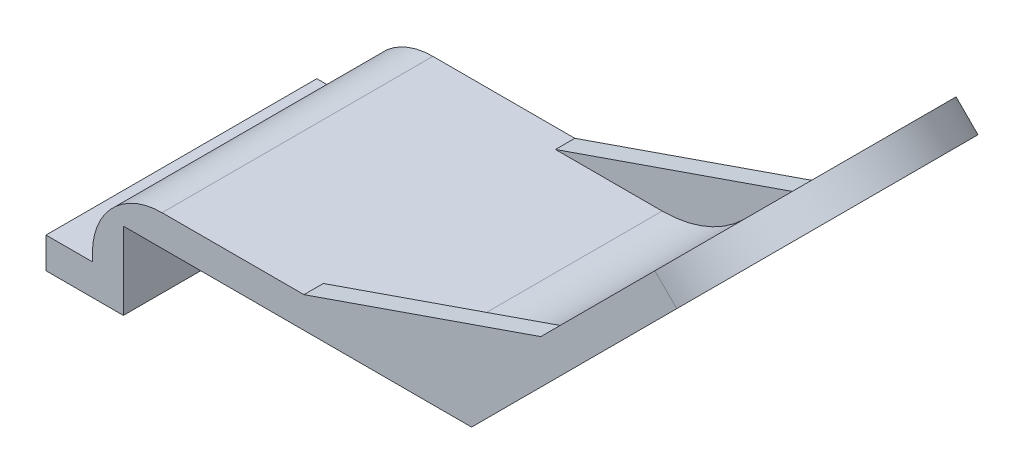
SolidWorks part; units mm, degrees
ref_plane "Front Plane" through (0, 0, 0) normal (0, 0, 1) x (1, 0, 0)
ref_plane "Top Plane" through (0, 0, 0) normal (0, 1, 0) x (1, 0, 0)
ref_plane "Right Plane" through (0, 0, 0) normal (1, 0, 0) x (0, 0, -1)
sketch "Sketch2" plane through (0, 0, 0) normal (0, 0, 1) x (1, 0, 0)
  line L0 (-279.4, -50.8) -> (-228.6, -50.8)
  line L1 (-228.6, -50.8) -> (-228.6, 0)
  line L2 (-228.6, 0) -> (0, 0)
  line L3 (0, 0) -> (134.7038, 134.7038)
extrude "Extrude-Thin1" add sketch "Sketch2" along normal mid plane 177.8 thin
sketch "Sketch3" plane through (-14.3684, 14.3684, 0) normal (-0.7071, 0.7071, 0) x (0, 0, 1)
  line L0 (88.9, 190.5) -> (-88.9, 190.5) construction
  line L1 (-88.9, 190.5) -> (88.9, 190.5)
  arc A0 (-88.9, 190.5) -> (88.9, 190.5) centre (0, 190.5) cw
extrude "Boss-Extrude1" add sketch "Sketch3" against normal up to surface (20.32 mm away)
sketch "Sketch4" plane through (-14.3684, 14.3684, 0) normal (-0.7071, 0.7071, 0) x (0, 0, 1)
  circle A0 centre (0, 190.5) radius 25.4
  dimension "D1" = 50.8
extrude "Cut-Extrude1" cut sketch "Sketch4" against normal through all
fillet "Fillet1" radius 38.1 1 edges at (102.3749, 131.1117, 0)
fillet "Fillet2" radius 45.72 1 edges at (-248.92, 20.32, 0)
sketch "Sketch5" plane through (0, 0, 88.9) normal (0, 0, 1) x (1, 0, 0)
  line L0 (-110.0168, 20.32) -> (45.4647, 74.2015)
  line L1 (-203.2, 20.32) -> (-8.4168, 20.32) construction
  line L2 (-8.4168, 20.32) -> (120.3354, 149.0723) construction
  dimension "D1" = 101.6
  dimension "D2" = 76.2
rib "Rib1" sketch "Sketch5" sketch "Sketch5" thickness 12.7 extrusion direction parallel to sketch draft on no parameters "D1"=12.7
mirror "Mirror1" about plane through (0, 0, 0) normal (0, 0, 1) of "Rib1"
fillet "Fillet3" radius 76.2 1 edges at (-8.4168, 20.32, 0)
equation "\"A\" = 9"
equation "\"B\"= 7"
equation "\"D1@Sketch2\"=\"A\""
equation "\"D1@Extrude-Thin1\"=\"B\""
